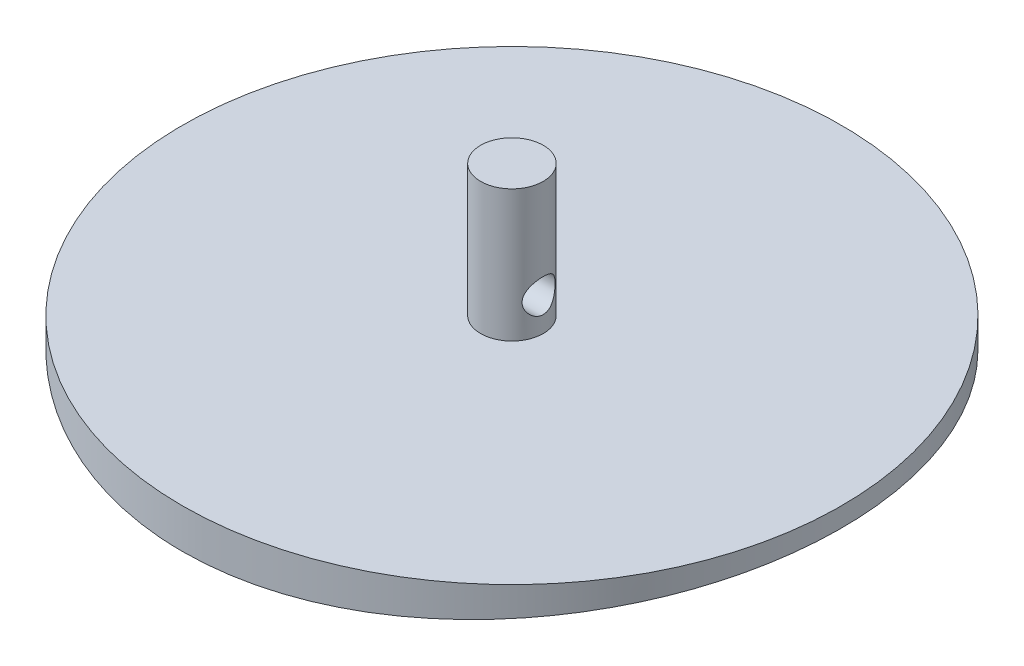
SolidWorks part; units mm, degrees
ref_plane "Front Plane" through (0, 0, 0) normal (0, 0, 1) x (1, 0, 0)
ref_plane "Top Plane" through (0, 0, 0) normal (0, 1, 0) x (1, 0, 0)
ref_plane "Right Plane" through (0, 0, 0) normal (1, 0, 0) x (0, 0, -1)
sketch "Sketch1" plane through (0, 0, 0) normal (0, 1, 0) x (1, 0, 0)
  circle A0 centre (0, 0) radius 50
  dimension "D1" = 100
extrude "Boss-Extrude1" add sketch "Sketch1" along normal blind 6
sketch "Sketch2" plane through (0, 6, 0) normal (0, 1, 0) x (1, 0, 0)
  circle A0 centre (0, 0) radius 4.75
  dimension "D1" = 9.5
extrude "Boss-Extrude2" add sketch "Sketch2" along normal blind 20
ref_plane "Plane1" through (4.75, 0, 0) normal (1, 0, 0) x (0, 0, -1)
sketch "Sketch3" plane through (4.75, 0, 0) normal (1, 0, 0) x (0, 0, -1)
  line L0 (0, 55) -> (0, -55) construction
  line L1 (4.75, 6) -> (-4.75, 6) construction
  circle A0 centre (0, 11) radius 2.5
  dimension "D1" = 5
  dimension "D2" = 5
extrude "Cut-Extrude1" cut sketch "Sketch3" against normal up to next
sketch "Sketch4" plane through (0, 0, 0) normal (1, 0, 0) x (0, 0, -1)
  line L0 (-50, 0) -> (50, 0) construction
  line L1 (55, 0) -> (-55, 0) construction
  line L2 (-50, 0) -> (50, 0)
  arc A0 (-50, 0) -> (50, 0) centre (0, -406.0553) cw
extrude "Cut-Extrude2" cut sketch "Sketch4" against normal up to next and the other way up to next
